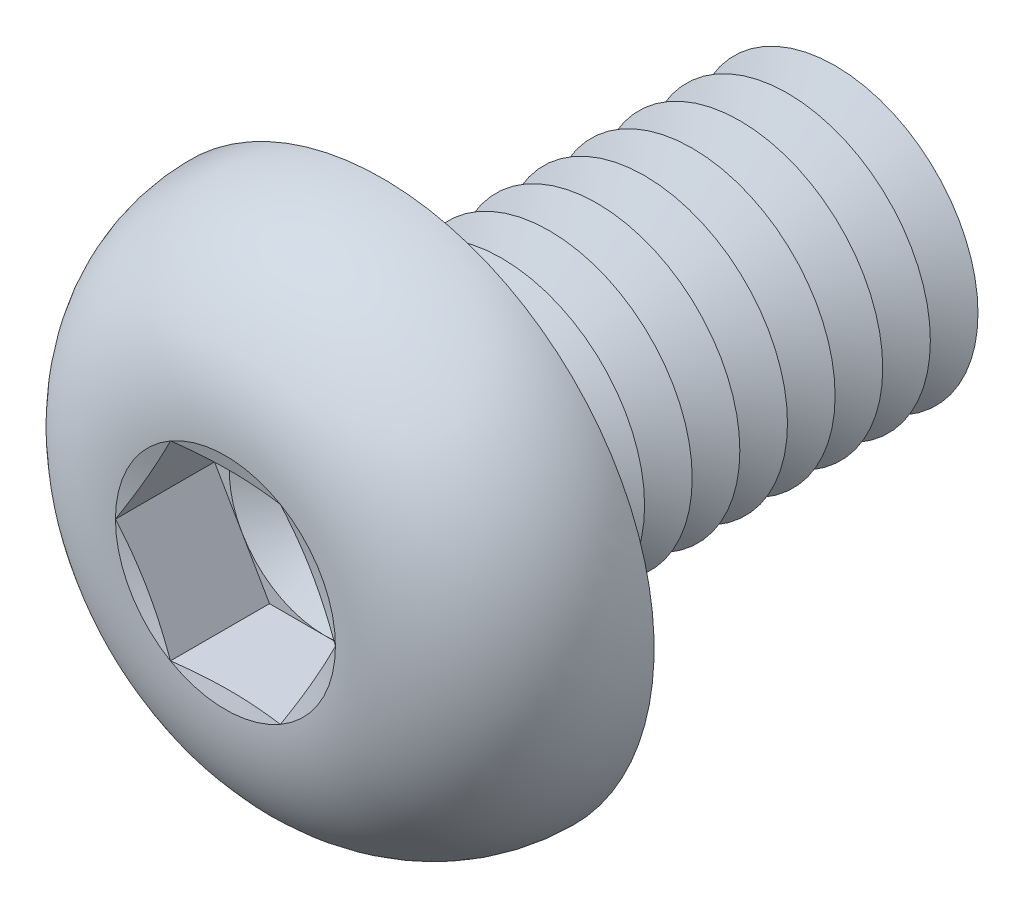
SolidWorks part; units mm, degrees
ref_plane "Front Plane" through (0, 0, 0) normal (0, 0, 1) x (1, 0, 0)
ref_plane "Top Plane" through (0, 0, 0) normal (0, 1, 0) x (1, 0, 0)
ref_plane "Right Plane" through (0, 0, 0) normal (1, 0, 0) x (0, 0, -1)
sketch "Sketch1" plane through (0, 0, 0) normal (1, 0, 0) x (0, 0, -1)
  line L0 (0, 1.5) -> (0, 2.85)
  line L3 (0, 1.5) -> (5, 1.5)
  line L4 (5, 1.5) -> (5, 0)
  line L5 (5, 0) -> (-1.65, 0) construction
  line L6 (-1.65, 0) -> (5, 0)
  line L7 (-1.65, 1.1547) -> (-1.65, 0.5773) construction
  line L8 (-1.65, 0.5773) -> (-1.65, 0)
  line L9 (-1.65, 1.1547) -> (-1.4953, 0.5773)
  line L10 (-1.4953, 0.5773) -> (-1.65, 0.5773)
  line L11 (5, 0) -> (22.7481, 0) construction
  line L12 (0, 2.85) -> (-1.65, 2.85) construction
  arc A1 (0, 2.85) -> (-1.65, 1.1547) centre (0, 1.1994) ccw
  point P8 (5, 0.75)
  dimension "D1" = 5.7
  dimension "D2" = 3
  dimension "D3" = 1.65
  dimension "D4" = 2.3094
  dimension "D5" = 5
  dimension "D6" = 15
revolve "Revolve1" add sketch "Sketch1" angle 360 about L5
fillet "Fillet1" radius 0.25 1 edges at (-1.5, 0, 0)
sketch "Sketch2" plane through (0, 0, 0) normal (1, 0, 0) x (0, 0, -1)
  line L0 (4.75, 1.5) -> (5.25, 1.5)
  line L1 (5, 1.5) -> (0.25, 1.5) construction
  line L2 (5.25, 1.5) -> (5, 1.067)
  line L3 (5, -1.5) -> (5, 1.5) construction
  line L4 (5, 1.067) -> (4.75, 1.5)
  dimension "D1" = 0.5
revolve "Cut-Revolve1" cut sketch "Sketch2" angle 360 about axis through (0, 0, -5) along (0, 0, -1)
pattern_linear "LPattern1" count 10 spacing 0.5 along (0, 0, 1) of "Cut-Revolve1"
sketch "Sketch3" plane through (0, 0, 1.65) normal (0, 0, 1) x (1, 0, 0)
  line L7 (0.5773, 1) -> (-0.5774, 1)
  line L8 (-0.5774, 1) -> (-1.1547, 0)
  line L9 (-1.1547, 0) -> (-0.5773, -1)
  line L10 (-0.5773, -1) -> (0.5773, -1)
  line L11 (0.5773, -1) -> (1.1547, 0)
  line L12 (1.1547, 0) -> (0.5773, 1)
  circle A0 centre (0, 0) radius 1 construction
  circle A3 centre (0, 0) radius 1.1547 construction
extrude "Cut-Extrude1" cut sketch "Sketch3" against normal blind 1.04
sketch "Sketch4" plane through (0, 0, 0.61) normal (0, 0, 1) x (1, 0, 0)
  line L1 (0.5773, 1) -> (-0.5774, 1) construction
  circle A0 centre (0, 0) radius 1
extrude "Cut-Extrude2" cut sketch "Sketch4" against normal through all draft 60
